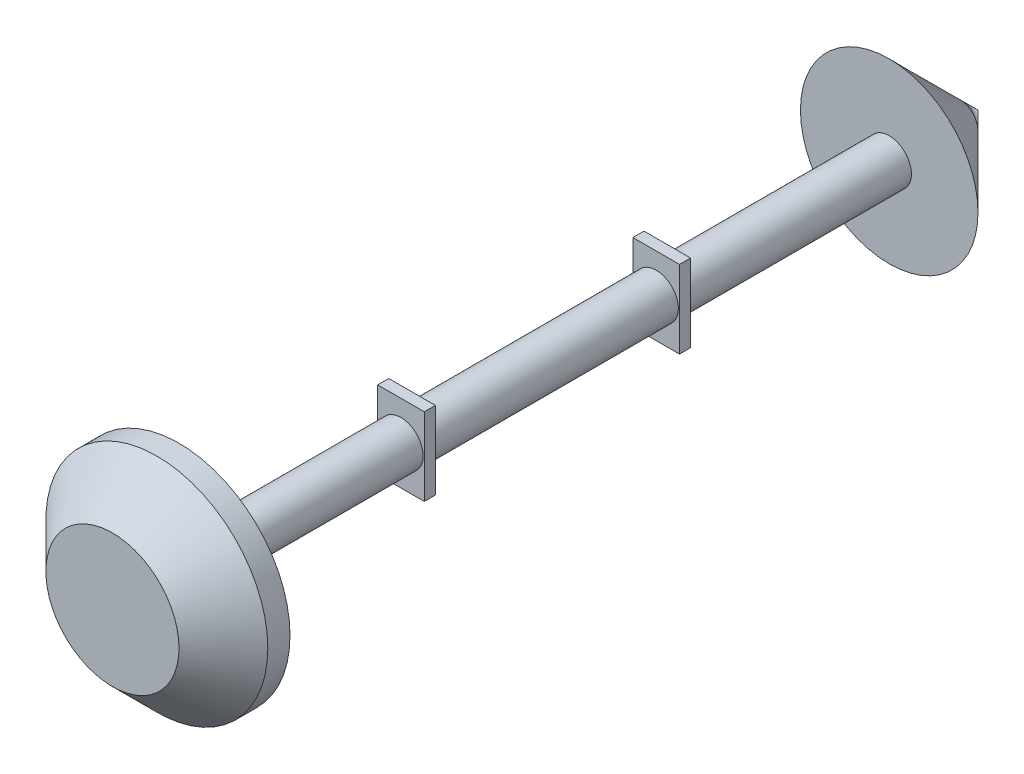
SolidWorks part; units mm, degrees
ref_plane "Plan de face" through (0, 0, 0) normal (0, 0, 1) x (1, 0, 0)
ref_plane "Plan de dessus" through (0, 0, 0) normal (0, 1, 0) x (1, 0, 0)
ref_plane "Plan de droite" through (0, 0, 0) normal (1, 0, 0) x (0, 0, -1)
sketch "Esquisse1" plane through (0, 0, 0) normal (0, 0, 1) x (1, 0, 0)
  circle A0 centre (0, 0) radius 10
  dimension "D1" = 20
extrude "Extrusion1" add sketch "Esquisse1" along normal blind 100
sketch "Esquisse2" plane through (0, 0, 0) normal (0, 0, -1) x (-1, 0, 0)
  line L1 (-10.5, 17.5) -> (10.5, 17.5)
  line L2 (-10.5, 17.5) -> (-10.5, -17.5)
  line L3 (-10.5, -17.5) -> (10.5, -17.5)
  line L4 (10.5, 17.5) -> (10.5, -17.5)
  dimension "D1" = 21
  dimension "D2" = 10.5
  dimension "D3" = 35
  dimension "D4" = 17.5
extrude "Extrusion2" add sketch "Esquisse2" along normal blind 5
sketch "Esquisse3" plane through (0, 0, -5) normal (0, 0, -1) x (-1, 0, 0)
  circle A0 centre (0, 0) radius 10 construction
  circle A1 centre (0, 0) radius 10
extrude "Extrusion3" add sketch "Esquisse3" along normal blind 110
sketch "Esquisse4" plane through (0, 0, -115) normal (0, 0, -1) x (-1, 0, 0)
  line L4 (-10.5, 17.5) -> (-10.5, -17.5)
  line L5 (-10.5, -17.5) -> (10.5, -17.5)
  line L6 (10.5, -17.5) -> (10.5, 17.5)
  line L7 (10.5, 17.5) -> (-10.5, 17.5)
  line L8 (-10.5, 17.5) -> (-10.5, -17.5)
  line L9 (-10.5, -17.5) -> (10.5, -17.5)
  line L10 (10.5, -17.5) -> (10.5, 17.5)
  line L11 (10.5, 17.5) -> (-10.5, 17.5)
  dimension "D1" = 0
extrude "Extrusion4" add sketch "Esquisse4" along normal blind 5
sketch "Esquisse5" plane through (0, 0, -120) normal (0, 0, -1) x (-1, 0, 0)
  circle A0 centre (0, 0) radius 10 construction
  circle A1 centre (0, 0) radius 10
extrude "Extrusion5" add sketch "Esquisse5" along normal blind 100
sketch "Esquisse7" plane through (0, 0, 100) normal (0, 0, 1) x (1, 0, 0)
  circle A0 centre (0, 0) radius 50
  dimension "D1" = 100
extrude "Extrusion7" add sketch "Esquisse7" along normal blind 30
sketch "Esquisse14" plane through (0, 0, 0) normal (1, 0, 0) x (0, 0, -1)
  line L0 (220, 0) -> (220, 40)
  line L2 (220, 40) -> (260, 0)
  line L3 (260, 0) -> (220, 0)
  line L4 (220, -10) -> (220, 10) construction
  dimension "D1" = 40
  dimension "D2" = 40
revolve "Révolution1" add sketch "Esquisse14" angle 360 about L3
sketch "Esquisse16" plane through (0, 0, 0) normal (0, 1, 0) x (1, 0, 0)
  line L0 (0, -100) -> (0, -210) construction
  line L1 (50, -100) -> (-50, -100) construction
  line L2 (-50, -130) -> (50, -130) construction
  dimension "D1" = 80
chamfer "Chanfrein2" distance 20 angle 45 1 edges at (50, 0, 130)
